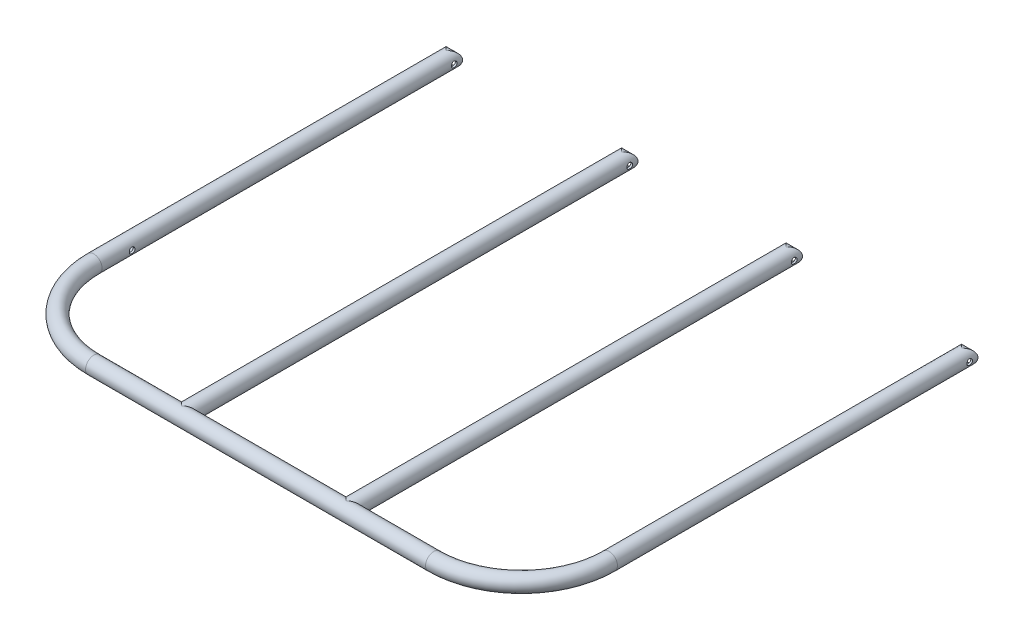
SolidWorks part; units mm, degrees
ref_plane "Front Plane" through (0, 0, 0) normal (0, 0, 1) x (1, 0, 0)
ref_plane "Top Plane" through (0, 0, 0) normal (0, 1, 0) x (1, 0, 0)
ref_plane "Right Plane" through (0, 0, 0) normal (1, 0, 0) x (0, 0, -1)
sketch "Sketch1" plane through (0, 0, 0) normal (0, 1, 0) x (1, 0, 0)
  line L0 (-298.45, 0) -> (-298.45, -419.1)
  line L1 (-196.85, -520.7) -> (196.85, -520.7)
  line L2 (298.45, -419.1) -> (298.45, 0)
  line L3 (-298.45, 0) -> (298.45, 0) construction
  line L4 (-95.25, 0) -> (-95.25, -520.7)
  line L5 (95.25, 0) -> (95.25, -520.7)
  line L6 (0, 0) -> (0, -270) construction
  arc A0 (-298.45, -419.1) -> (-196.85, -520.7) centre (-196.85, -419.1) ccw
  arc A1 (196.85, -520.7) -> (298.45, -419.1) centre (196.85, -419.1) ccw
  dimension "D3" = 101.6
  dimension "D1" = 596.9
  dimension "D2" = 520.7
  dimension "D4" = 190.5
other "Al round tubing 0.75 OD X 0.083 WALL(1)"
ref_plane "Plane3" through (-298.45, 0, 0) normal (0, 0, 1) x (1, 0, 0)
sketch "Sketch18" plane through (-298.45, 0, 0) normal (0, 0, 1) x (1, 0, 0)
  circle A0 centre (0, 0) radius 7.4168
  circle A1 centre (0, 0) radius 9.525
  point P3 (0, 0)
  dimension "In_dia" = 14.8336
  dimension "Out_dia" = 19.05
sketch "Sketch12" plane through (0, 0, 0) normal (1, 0, 0) x (0, 0, -1)
  line L0 (0, 50) -> (0, -50) construction
  line L1 (0, 0) -> (-520.7, 0) construction
  circle A0 centre (-11.1125, 0) radius 3.2639
  dimension "D1" = 6.5278
  dimension "D2" = 11.1125
extrude "Cut-Extrude1" cut sketch "Sketch12" against normal through all and the other way through all
ref_plane "Plane2" through (-298.45, 0, 0) normal (1, 0, 0) x (0, 0, -1)
sketch "Sketch14" plane through (0, 0, 0) normal (1, 0, 0) x (0, 0, -1)
  line L0 (-50, 9.525) -> (-11.1125, 9.525)
  line L1 (-11.1125, -9.525) -> (-60, -9.525)
  line L4 (0, 9.525) -> (-419.1, 9.525) construction
  line L5 (-419.1, -9.525) -> (0, -9.525) construction
  arc A0 (-11.1125, 9.525) -> (-11.1125, -9.525) centre (-11.1125, 0) cw
  circle A2 centre (-11.1125, 0) radius 3.2639 construction
extrude "Cut-Extrude2" cut sketch "Sketch14" against normal through all and the other way through all
sketch "Sketch19" plane through (0, 0, 0) normal (1, 0, 0) x (0, 0, -1)
  line L0 (-384.175, 0) -> (0, 0) construction
  circle A0 centre (-384.175, 0) radius 3.3782
  dimension "D2" = 6.7564
  dimension "D1" = 384.175
extrude "Cut-Extrude3" cut sketch "Sketch19" against normal through all
